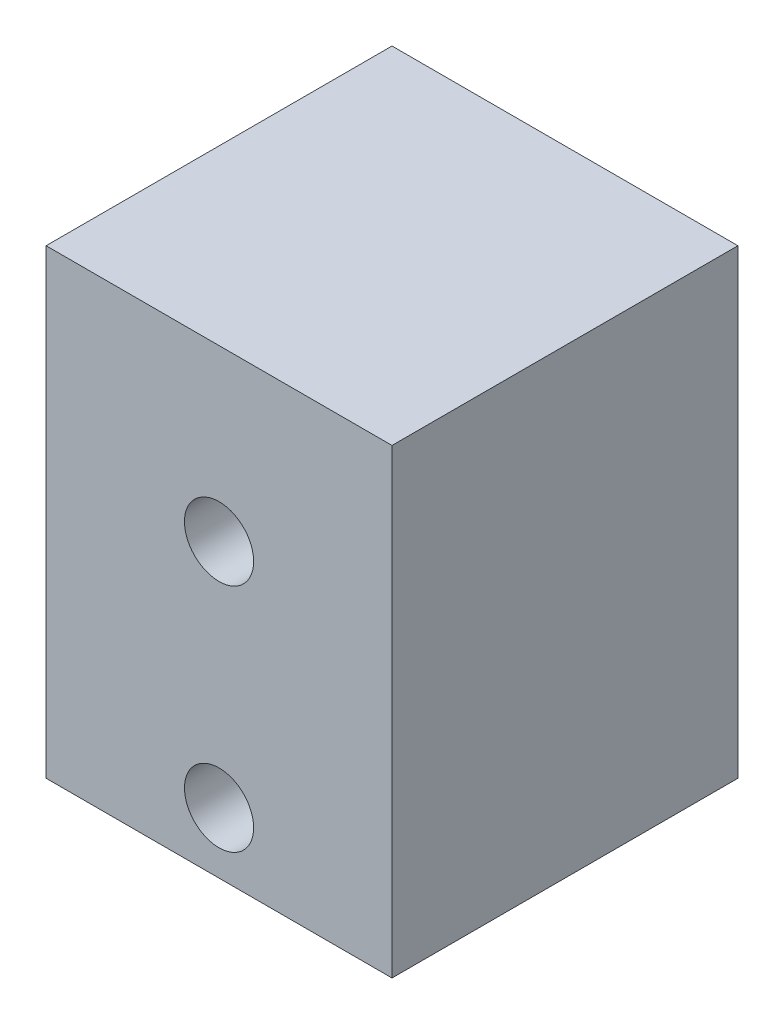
SolidWorks part; units mm, degrees
ref_plane "Plan de face" through (0, 0, 0) normal (0, 0, 1) x (1, 0, 0)
ref_plane "Plan de dessus" through (0, 0, 0) normal (0, 1, 0) x (1, 0, 0)
ref_plane "Plan de droite" through (0, 0, 0) normal (1, 0, 0) x (0, 0, -1)
sketch "Esquisse1" plane through (0, 0, 0) normal (0, 0, 1) x (1, 0, 0)
  line L0 (15, 40) -> (15, 0) construction
  line L1 (0, 0) -> (30, 0)
  line L2 (0, 0) -> (0, 40)
  line L3 (0, 40) -> (30, 40)
  line L4 (30, 0) -> (30, 40)
  circle A0 centre (15, 5.2805) radius 3
  circle A1 centre (15, 25.2805) radius 3
  dimension "D5" = 6
  dimension "D6" = 6
  dimension "D1" = 30
  dimension "D2" = 40
  dimension "D4" = 20
extrude "Extrusion1" add sketch "Esquisse1" along normal blind 30
